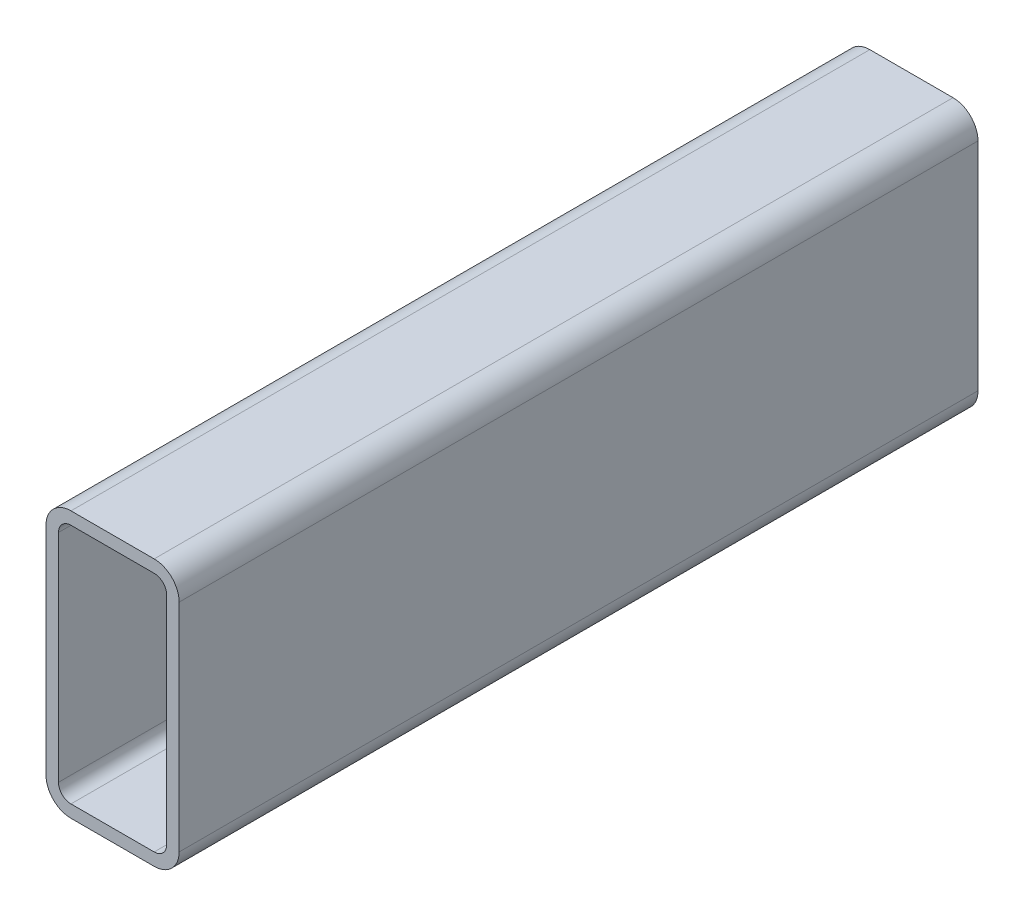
SolidWorks part; units mm, degrees
ref_plane "Front Plane" through (0, 0, 0) normal (0, 0, 1) x (1, 0, 0)
ref_plane "Top Plane" through (0, 0, 0) normal (0, 1, 0) x (1, 0, 0)
ref_plane "Right Plane" through (0, 0, 0) normal (1, 0, 0) x (0, 0, -1)
sketch "Sketch1" plane through (0, 0, 0) normal (0, 0, 1) x (1, 0, 0)
  line B0 (9.525, 96.8375) -> (41.275, 96.8375)
  arc B1 (46.0375, 92.075) -> (41.275, 96.8375) centre (41.275, 92.075) ccw
  line B2 (46.0375, 92.075) -> (46.0375, 9.525)
  arc B3 (41.275, 4.7625) -> (46.0375, 9.525) centre (41.275, 9.525) ccw
  line B4 (41.275, 4.7625) -> (9.525, 4.7625)
  arc B5 (4.7625, 9.525) -> (9.525, 4.7625) centre (9.525, 9.525) ccw
  line B6 (4.7625, 9.525) -> (4.7625, 92.075)
  arc B7 (9.525, 96.8375) -> (4.7625, 92.075) centre (9.525, 92.075) ccw
  line B8 (9.525, 101.6) -> (41.275, 101.6)
  arc B9 (50.8, 92.075) -> (41.275, 101.6) centre (41.275, 92.075) ccw
  line B10 (50.8, 92.075) -> (50.8, 9.525)
  arc B11 (41.275, 0) -> (50.8, 9.525) centre (41.275, 9.525) ccw
  line B12 (41.275, 0) -> (9.525, 0)
  arc B13 (0, 9.525) -> (9.525, 0) centre (9.525, 9.525) ccw
  line B14 (0, 9.525) -> (0, 92.075)
  arc B15 (9.525, 101.6) -> (0, 92.075) centre (9.525, 92.075) ccw
sketch_block_instance "HSS4x2x0.1875-1"
sketch_block "HSS4x2x0.1875"
extrude "Boss-Extrude1" add sketch "Sketch1" along normal blind 304.8
